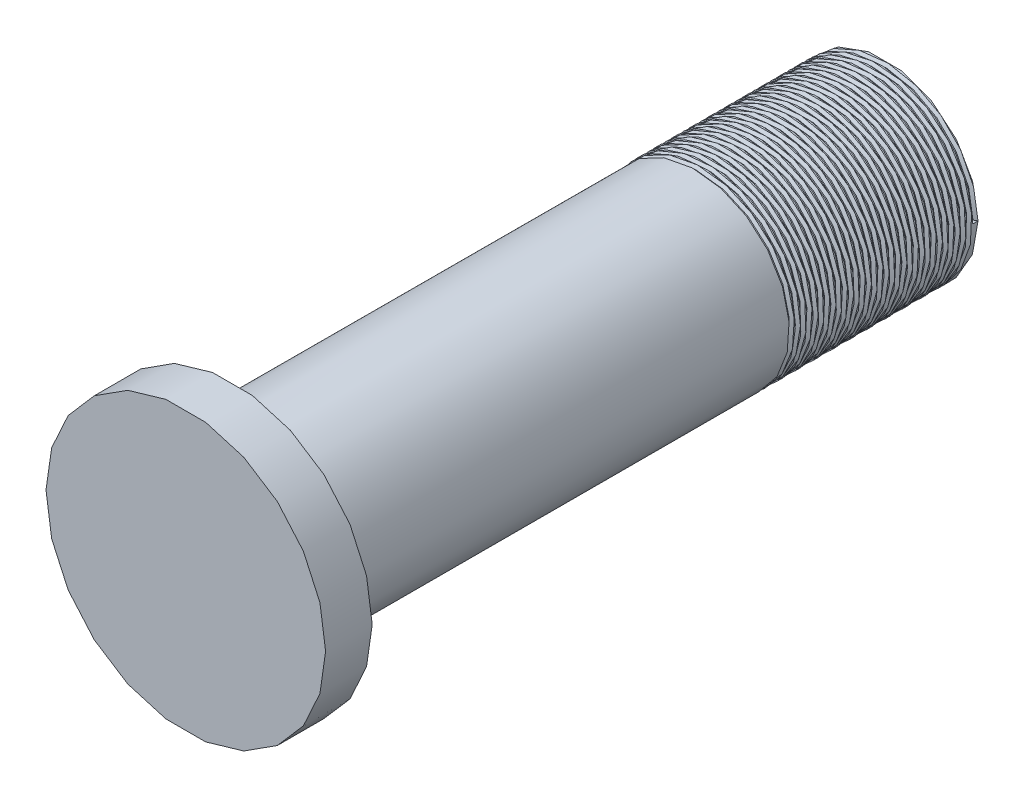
SolidWorks part; units mm, degrees
ref_plane "Спереди" through (0, 0, 0) normal (0, 0, 1) x (1, 0, 0)
ref_plane "Сверху" through (0, 0, 0) normal (0, 1, 0) x (1, 0, 0)
ref_plane "Справа" through (0, 0, 0) normal (1, 0, 0) x (0, 0, -1)
sketch "Эскиз1" plane through (0, 0, 0) normal (0, 0, 1) x (1, 0, 0)
  circle A0 centre (0, 0) radius 10
  dimension "D1" = 20
extrude "Бобышка-Вытянуть1" add sketch "Эскиз1" along normal blind 70
thread "Резьба1" pitch 0.635 start angle 0, offset 0, length 20, pitch 0.635, diameter 20
ref_plane "Плоскость1" through (10, 0, 0) normal (0, -1, 0) x (1, 0, 0)
sketch "Профиль резьбы1" plane through (10, 0, 0) normal (0, -1, 0) x (1, 0, 0)
  line L0 (0, 0) -> (0, 0.635) construction
  line L11 (0, 0) -> (0, 0.5556)
  line L12 (0, 0.5556) -> (-0.3437, 0.3572)
  line L13 (-0.3437, 0.3572) -> (-0.3437, 0.1984)
  line L15 (-0.3437, 0.1984) -> (0, 0)
  line L17 (-0.3437, 0.2778) -> (0, 0.2778) construction
  point P2 (0, 0)
  dimension "Pitch" = 0.635
  dimension "Profile_Angle" = 60
  dimension "Profile_Land" = 0.1588
  dimension "Profile_Height" = 0.3437
sketch "Эскиз8" plane through (0, 0, 70) normal (0, 0, 1) x (1, 0, 0)
  circle A0 centre (0, 0) radius 15
  dimension "D1" = 30
extrude "Бобышка-Вытянуть2" add sketch "Эскиз8" along normal blind 5 contours A0
